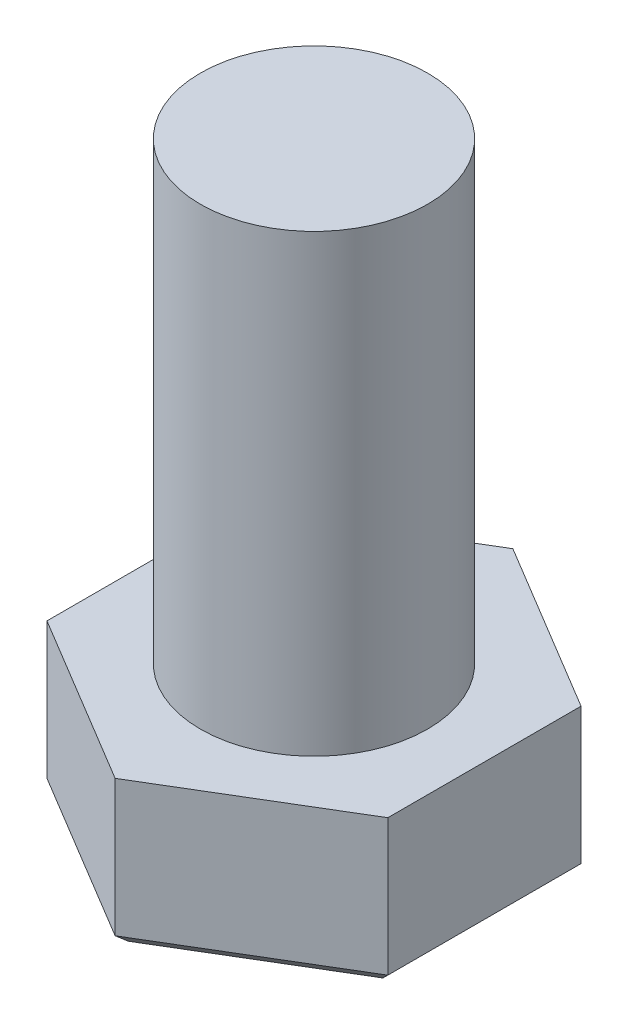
SolidWorks part; units mm, degrees
ref_plane "Plan de face" through (0, 0, 0) normal (0, 0, 1) x (1, 0, 0)
ref_plane "Plan de dessus" through (0, 0, 0) normal (0, 1, 0) x (1, 0, 0)
ref_plane "Plan de droite" through (0, 0, 0) normal (1, 0, 0) x (0, 0, -1)
sketch "Esquisse1" plane through (0, 0, 0) normal (0, 0, 1) x (1, 0, 0)
  line L0 (0, 40) -> (0, 0) construction
  line L1 (0, 40) -> (10, 40)
  line L2 (10, 40) -> (10, 0)
  line L3 (10, 0) -> (0, 0)
  line L4 (0, 40) -> (0, 0)
  dimension "D1" = 40
  dimension "D2" = 20
revolve "Révolution1" add sketch "Esquisse1" angle 360 about L0
sketch "Esquisse2" plane through (0, 0, 0) normal (0, -1, 0) x (1, 0, 0)
  line L0 (0, 17.5) -> (0, 0) construction
  line L1 (0, 0) -> (-15, 0) construction
  line L2 (-15, -8.5) -> (-15, 8.5)
  line L3 (-15, 8.5) -> (0, 17.5)
  line L4 (15, 8.5) -> (0, 17.5)
  line L5 (15, -8.5) -> (15, 8.5)
  line L6 (-15, -8.5) -> (0, -17.5)
  line L7 (15, -8.5) -> (0, -17.5)
  point P11 (15, 0)
  dimension "D1" = 17
  dimension "D2" = 35
  dimension "D3" = 30
extrude "Extrusion1" add sketch "Esquisse2" along normal blind 13
chamfer "Chanfrein1" distance 1 angle 45 6 edges at (7.5, -13, -13) (15, -13, 0) (7.5, -13, 13) (-7.5, -13, 13) (-15, -13, 0) (-7.5, -13, -13)
